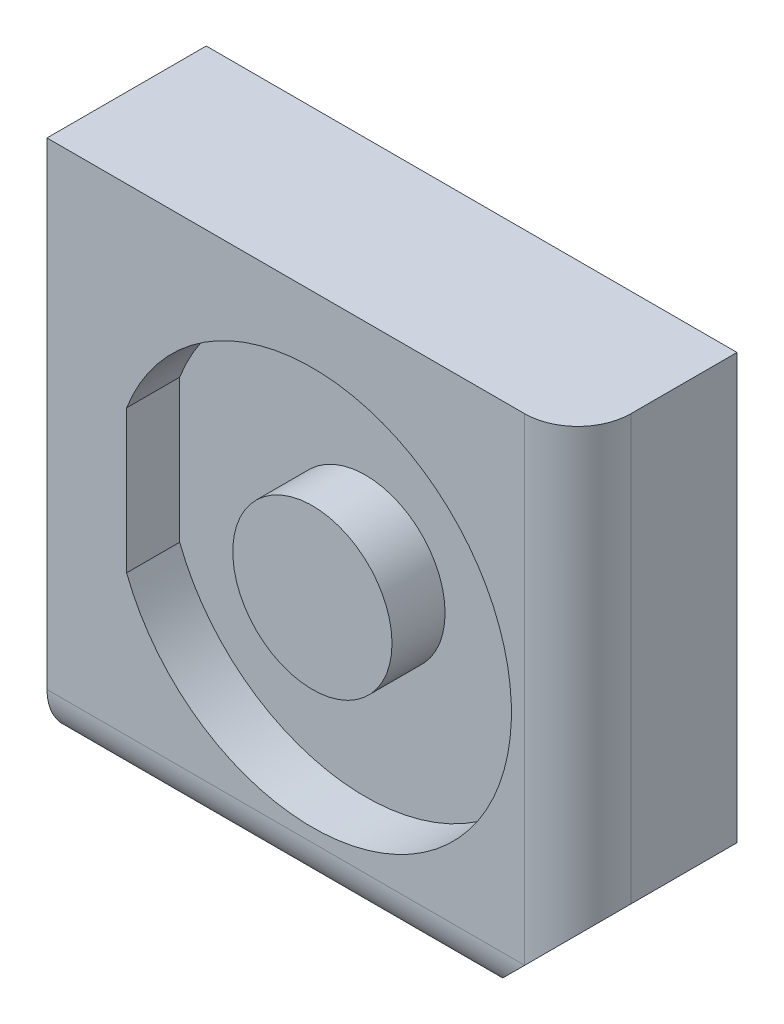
SolidWorks part; units mm, degrees
ref_plane "正面" through (0, 0, 0) normal (0, 0, 1) x (1, 0, 0)
ref_plane "平面" through (0, 0, 0) normal (0, 1, 0) x (1, 0, 0)
ref_plane "右側面" through (0, 0, 0) normal (1, 0, 0) x (0, 0, -1)
sketch "ｽｹｯﾁ1" plane through (0, 0, 0) normal (0, 0, 1) x (1, 0, 0)
  line L0 (-50, 50) -> (50, -50) construction
  line L1 (-50, 50) -> (50, 50)
  line L2 (-50, 50) -> (-50, -50)
  line L3 (-50, -50) -> (50, -50)
  line L4 (50, 50) -> (50, -50)
  dimension "D1" = 100
extrude "ﾎﾞｽ - 押し出し1" add sketch "ｽｹｯﾁ1" along normal blind 30
sketch "ｽｹｯﾁ2" plane through (0, 0, 30) normal (0, 0, 1) x (1, 0, 0)
  line L0 (-35, 13.4629) -> (-35, -13.4629)
  arc A0 (-35, -13.4629) -> (-35, 13.4629) centre (0, 0) ccw
  circle A1 centre (0, 0) radius 15
  dimension "D1" = 75
  dimension "D3" = 30
  dimension "D2" = 35
extrude "ｶｯﾄ - 押し出し1" cut sketch "ｽｹｯﾁ2" against normal blind 10
fillet "ﾌｨﾚｯﾄ1" radius 10 2 edges at (0, -50, 30) (50, 0, 30)
chamfer "面取り1" distance 20 angle 45 2 edges at (47.0711, -47.0711, 27.0711) (50, -50, 10)
